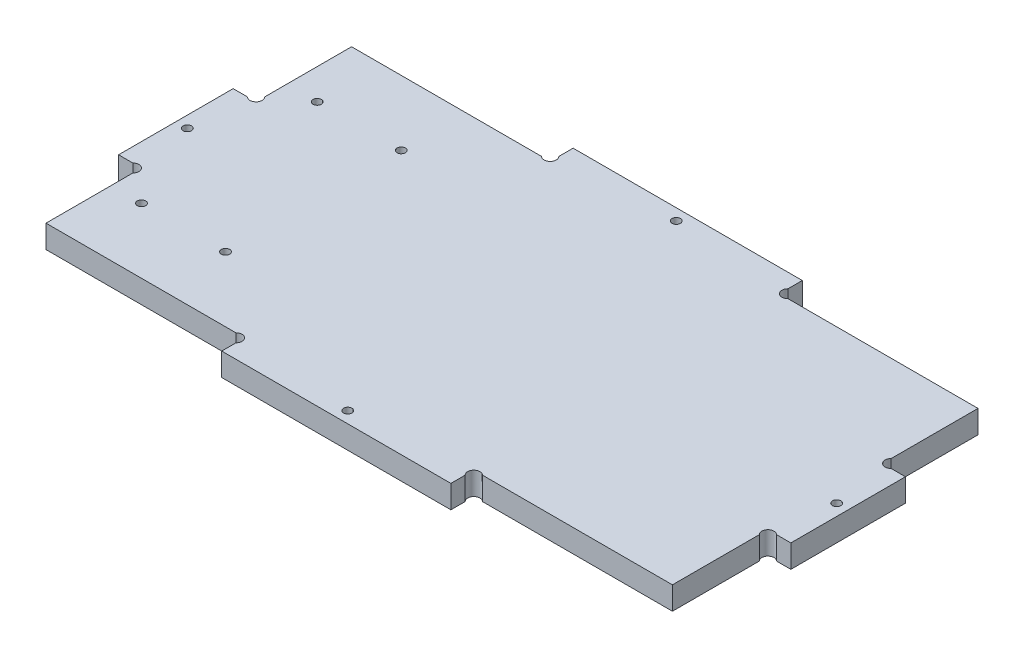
SolidWorks part; units mm, degrees
ref_plane "Plan de face" through (0, 0, 0) normal (0, 0, 1) x (1, 0, 0)
ref_plane "Plan de dessus" through (0, 0, 0) normal (0, 1, 0) x (1, 0, 0)
ref_plane "Plan de droite" through (0, 0, 0) normal (1, 0, 0) x (0, 0, -1)
sketch "Esquisse1" plane through (0, 0, 0) normal (0, 1, 0) x (1, 0, 0)
  line L0 (0, -17.0026) -> (0, 193.7463) construction
  line L1 (-65.4634, 0) -> (262.3041, 0) construction
  line L2 (-62.7574, 152) -> (265.0101, 152) construction
  line L3 (176, 193.7463) -> (176, -17.0026) construction
  line L4 (-42.9041, 106) -> (131.6555, 106) construction
  line L5 (6, -17.0026) -> (6, 178.5107) construction
  line L6 (88, 131.8413) -> (88, 70.7829) construction
  line L7 (58, 178.5107) -> (58, 142.4654) construction
  line L8 (120.2627, 146) -> (170, 146)
  line L9 (118, 178.5107) -> (118, 142.4654) construction
  line L10 (120.2627, 66) -> (170, 66)
  line L11 (25, 106) -> (25, 128.0734) construction
  line L12 (44.0803, 149) -> (179.572, 149) construction
  line L13 (265.0101, 146) -> (-3.4358, 146) construction
  line L14 (88, 165.8763) -> (88, 142.4654) construction
  line L15 (10, 133) -> (40, 133) construction
  line L16 (58, 146) -> (45.5232, 158.4768) construction
  line L17 (-26.8754, 121) -> (13.3335, 121) construction
  line L18 (6, 121) -> (-14.0398, 141.0398) construction
  line L19 (3.7373, 121) -> (0, 121)
  line L20 (3.7373, 91) -> (0, 91)
  line L21 (0, 121) -> (0, 91)
  line L22 (6, 123.2627) -> (6, 146)
  line L23 (6, 146) -> (55.7373, 146)
  line L24 (58, 148.2627) -> (58, 152)
  line L25 (58, 152) -> (118, 152)
  line L26 (118, 152) -> (118, 148.2627)
  line L27 (10, 133) -> (10, 79) construction
  line L28 (10, 79) -> (40, 79) construction
  line L29 (40, 133) -> (40, 79) construction
  line L30 (10, 133) -> (40, 79) construction
  line L31 (10, 79) -> (40, 133) construction
  line L37 (118, 60) -> (118, 63.7373)
  line L38 (58, 60) -> (118, 60)
  line L39 (58, 63.7373) -> (58, 60)
  line L40 (6, 66) -> (55.7373, 66)
  line L41 (6, 88.7373) -> (6, 66)
  line L42 (170, 88.7373) -> (170, 66)
  line L43 (170, 123.2627) -> (170, 146)
  line L44 (176, 121) -> (176, 91)
  line L45 (172.2627, 91) -> (176, 91)
  line L46 (172.2627, 121) -> (176, 121)
  line L47 (3, 110.6775) -> (3, 61.1353) construction
  arc A0 (55.7373, 146) -> (58, 148.2627) centre (56.8686, 147.1314) ccw
  arc A1 (120.2627, 146) -> (118, 148.2627) centre (119.1314, 147.1314) cw
  circle A2 centre (88, 149) radius 1.1
  circle A3 centre (88, 63) radius 1.1
  arc A4 (3.7373, 121) -> (6, 123.2627) centre (4.8686, 122.1314) ccw
  arc A5 (3.7373, 91) -> (6, 88.7373) centre (4.8686, 89.8686) cw
  circle A6 centre (3, 106) radius 1.1
  circle A7 centre (173, 106) radius 1.1
  arc A8 (120.2627, 66) -> (118, 63.7373) centre (119.1314, 64.8686) ccw
  arc A9 (55.7373, 66) -> (58, 63.7373) centre (56.8686, 64.8686) cw
  arc A10 (172.2627, 91) -> (170, 88.7373) centre (171.1314, 89.8686) ccw
  arc A11 (172.2627, 121) -> (170, 123.2627) centre (171.1314, 122.1314) cw
  circle A12 centre (14, 83) radius 1.1
  circle A13 centre (14, 129) radius 1.1
  circle A14 centre (36, 129) radius 1.1
  circle A15 centre (36, 83) radius 1.1
  point P41 (25, 106)
  dimension "D16" = 15
  dimension "D18" = 3
  dimension "D8" = 10
  dimension "D1" = 152
  dimension "D2" = 46
  dimension "D3" = 176
  dimension "D4" = 88
  dimension "D5" = 6
  dimension "D6" = 60
  dimension "D7" = 3
  dimension "D9" = 4
  dimension "D10" = 52
  dimension "D11" = 6
  dimension "D12" = 30
  dimension "D13" = 4
  dimension "D15" = 45
  dimension "D17" = 45
extrude "Boss.-Extru.1" add sketch "Esquisse1" along normal blind 6
